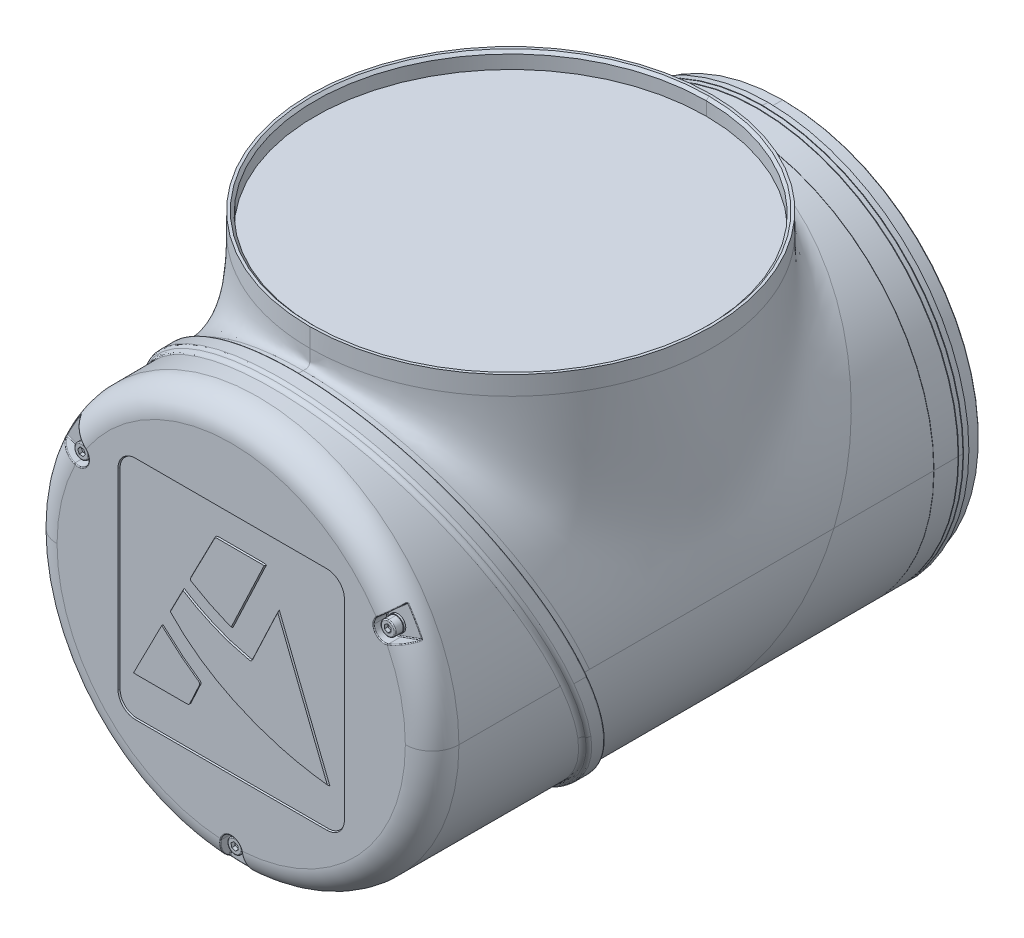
SolidWorks part; units mm, degrees
ref_plane "前视基准面" through (0, 0, 0) normal (0, 0, 1) x (1, 0, 0)
ref_plane "上视基准面" through (0, 0, 0) normal (0, 1, 0) x (1, 0, 0)
ref_plane "右视基准面" through (0, 0, 0) normal (1, 0, 0) x (0, 0, -1)
imported_body "输入1"
chamfer "倒角1" distance 0.5 angle 45
ref_plane "基准面1" through (0, -17.3669, 40.9137) normal (0, 0.3907, -0.9205) x (-1, 0, 0)
ref_plane "基准面2" through (0, 0, -92) normal (0, 0, -1) x (-1, 0, 0)
ref_plane "基准面3" through (0, 0, -83) normal (0, 0, 1) x (1, 0, 0)
split "分割1" trim tools "基准面3", "基准面2", "基准面1" bodies to split 106 resulting bodies 107 108 109 110
